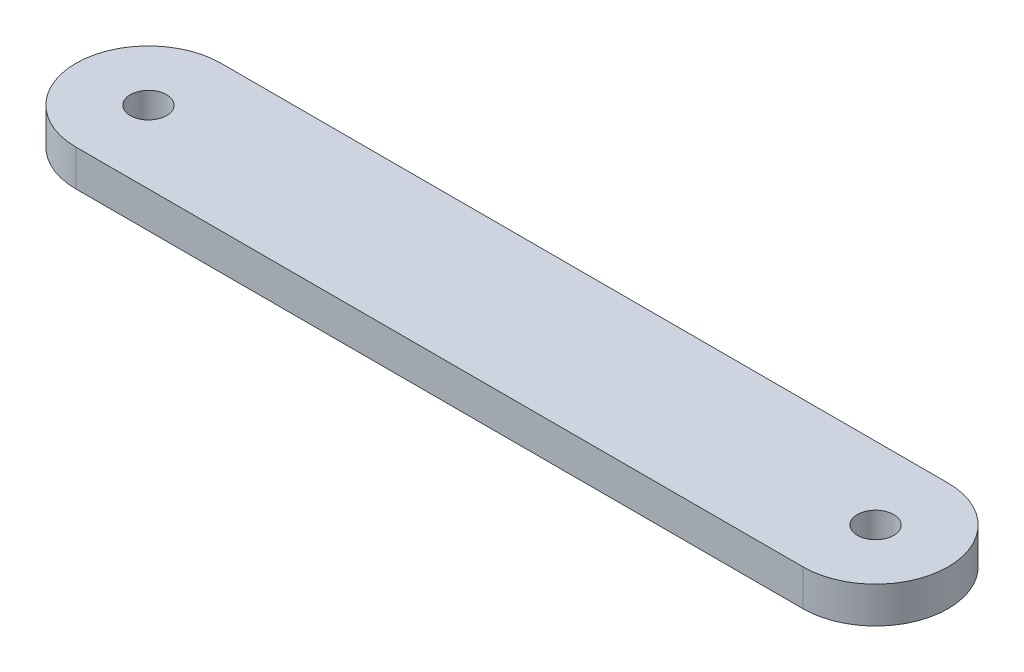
SolidWorks part; units mm, degrees
ref_plane "Front Plane" through (0, 0, 0) normal (0, 0, 1) x (1, 0, 0)
ref_plane "Top Plane" through (0, 0, 0) normal (0, 1, 0) x (1, 0, 0)
ref_plane "Right Plane" through (0, 0, 0) normal (1, 0, 0) x (0, 0, -1)
sketch "Sketch1" plane through (0, 0, 0) normal (0, 1, 0) x (1, 0, 0)
  line L0 (0, 12.7) -> (127.254, 12.7)
  line L1 (0, -12.7) -> (127.254, -12.7)
  circle A0 centre (0, 0) radius 3.175
  circle A1 centre (0, 0) radius 12.7
  circle A2 centre (127.254, 0) radius 12.7
  circle A3 centre (127.254, 0) radius 3.175
  dimension "D1" = 6.35
  dimension "D2" = 25.4
  dimension "D3" = 127.254
  dimension "D4" = 25.4
  dimension "D5" = 6.35
  dimension "D6" = 127.254
  dimension "D7" = 12.7
extrude "Boss-Extrude1" add sketch "Sketch1" along normal blind 6.35 contours A1 A0 | A2 L0 A1 L1 | A2 A3
